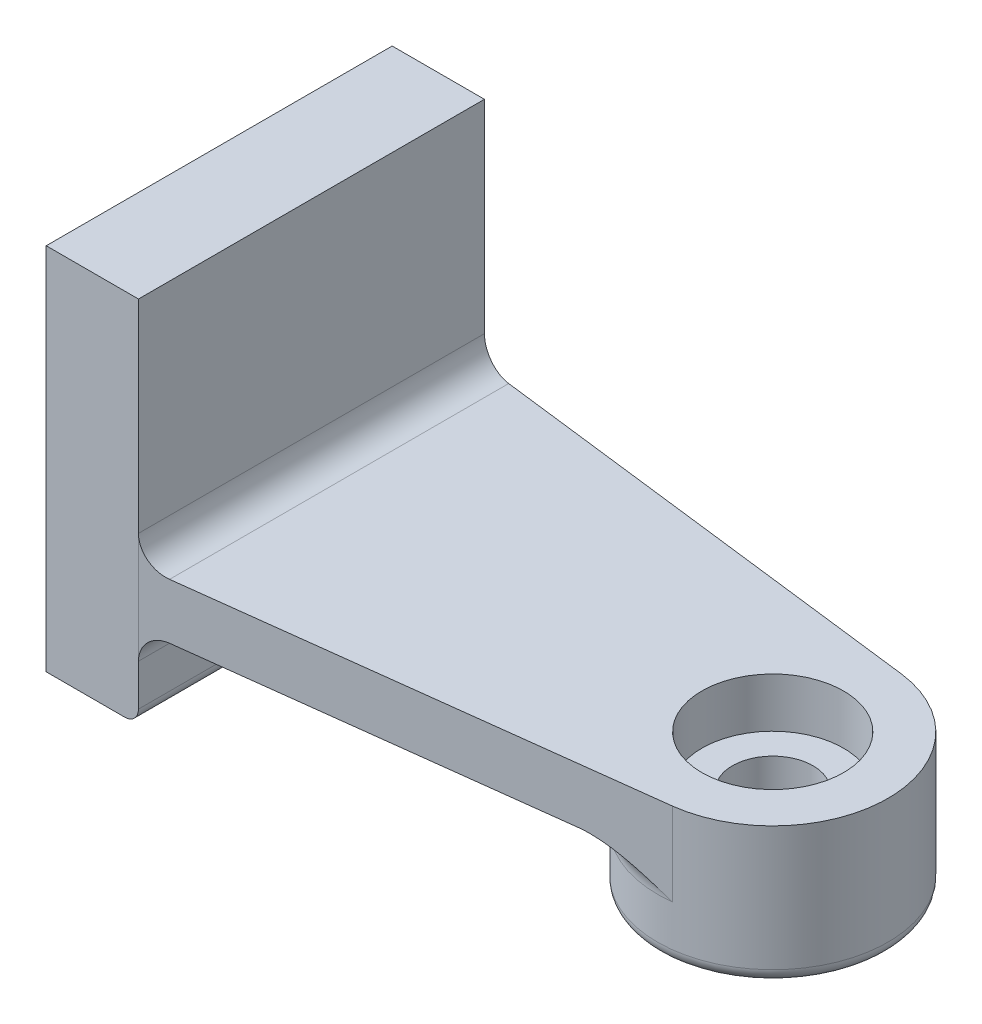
SolidWorks part; units mm, degrees
ref_plane "Front" through (0, 0, 0) normal (0, 0, 1) x (1, 0, 0)
ref_plane "Top" through (0, 0, 0) normal (0, 1, 0) x (1, 0, 0)
ref_plane "Right" through (0, 0, 0) normal (1, 0, 0) x (0, 0, -1)
sketch "Sketch2" plane through (0, 0, 0) normal (0, 1, 0) x (1, 0, 0)
  line L0 (0, 0) -> (103.8125, 0) construction
  line L1 (0, 37.5) -> (103.0548, 24.8127)
  line L2 (0, -37.5) -> (103.0548, -24.8127)
  line L3 (0, 37.5) -> (0, -37.5)
  arc A0 (103.0548, 24.8127) -> (103.0548, -24.8127) centre (100, 0) cw
  dimension "D1" = 25
  dimension "D2" = 75
  dimension "Length" = 100
extrude "Base-Extrude" add sketch "Sketch2" along normal blind 12
sketch "Sketch4" plane through (0, 0, 0) normal (-1, 0, 0) x (0, 0, 1)
  line L0 (-37.5, 12) -> (37.5, 12) construction
  line L1 (-37.5, 62) -> (37.5, 62)
  line L2 (-37.5, 62) -> (-37.5, -18)
  line L3 (-37.5, -18) -> (37.5, -18)
  line L4 (37.5, 62) -> (37.5, -18)
  line L5 (-37.5, 12) -> (-37.5, 0) construction
  line L6 (37.5, 12) -> (37.5, 0) construction
  dimension "Height" = 80
  dimension "D2" = 50
extrude "Boss-Extrude1" add sketch "Sketch4" along normal blind 20
sketch "Sketch5" plane through (0, 0, 0) normal (0, -1, 0) x (1, 0, 0)
  circle A0 centre (100, 0) radius 25
extrude "Boss-Extrude2" add sketch "Sketch5" along normal up to surface (18 mm away)
sketch "Sketch6" plane through (0, 0, 0) normal (0, 0, 1) x (1, 0, 0)
  line L0 (0, -18) -> (125, -18)
  line L1 (75, -18) -> (125, -18) construction
rib "Rib1" sketch "Sketch6" sketch "Sketch6" thickness 12 extrusion direction parallel to sketch draft on no parameters "D1"=12
hole_wizard "CBORE for M16 Hex Head Bolt1" positions "Sketch10" profile "Sketch9" counterbore size "M16" standard "Ansi Metric"
sketch "Sketch10" plane through (0, 12, 0) normal (0, 1, 0) x (-1, 0, 0)
  arc A0 (-103.0548, 24.8127) -> (-103.0548, -24.8127) centre (-100, 0) ccw construction
  point P0 (-100, 0)
sketch "Sketch9" plane through (100, 12, 0) normal (1, 0, 0) x (0, 0, 1)
  line L0 (0, 0) -> (0, 30)
  line L1 (0, 30) -> (8.75, 30)
  line L3 (8.75, 30) -> (8.75, 10.75)
  line L4 (8.75, 10.75) -> (15.355, 10.75)
  line L5 (15.355, 10.75) -> (15.355, 0)
  line L7 (15.355, 0) -> (0, 0)
  line L11 (0, -6.35) -> (0, 107.95) construction
  dimension "Thru Hole Dia." = 17.5
  dimension "Thru Hole Depth" = 30
  dimension "C'Bore Dia." = 30.71
  dimension "C'Bore Depth" = 10.75
fillet "Fillet1" radius 6 9 edges at (75.7307, -9, 6) (75.7307, -9, -6)
fillet "Fillet2" radius 6 11 edges at (87.4608, 0, -21.628) (0, -12, 6) (0, -12, -6) (38.7084, 0, -6) (1.7574, -1.7574, -6) (87.4608, 0, 21.628) (74.7383, 0, -7.0032) (38.7084, 0, 6) (1.7574, -1.7574, 6) (74.7383, 0, 7.0032)
fillet "Fillet11" radius 3 9 edges at (0, -18, -24.75) (1.7574, -18, -7.7574) (0, -18, 24.75) (1.7574, -18, 7.7574) (38.7084, -18, 6) (74.7383, -18, 7.0032) (125, -18, 0) (74.7383, -18, -7.0032) (38.7084, -18, -6)
fillet "Fillet12" [suppressed] radius 3
